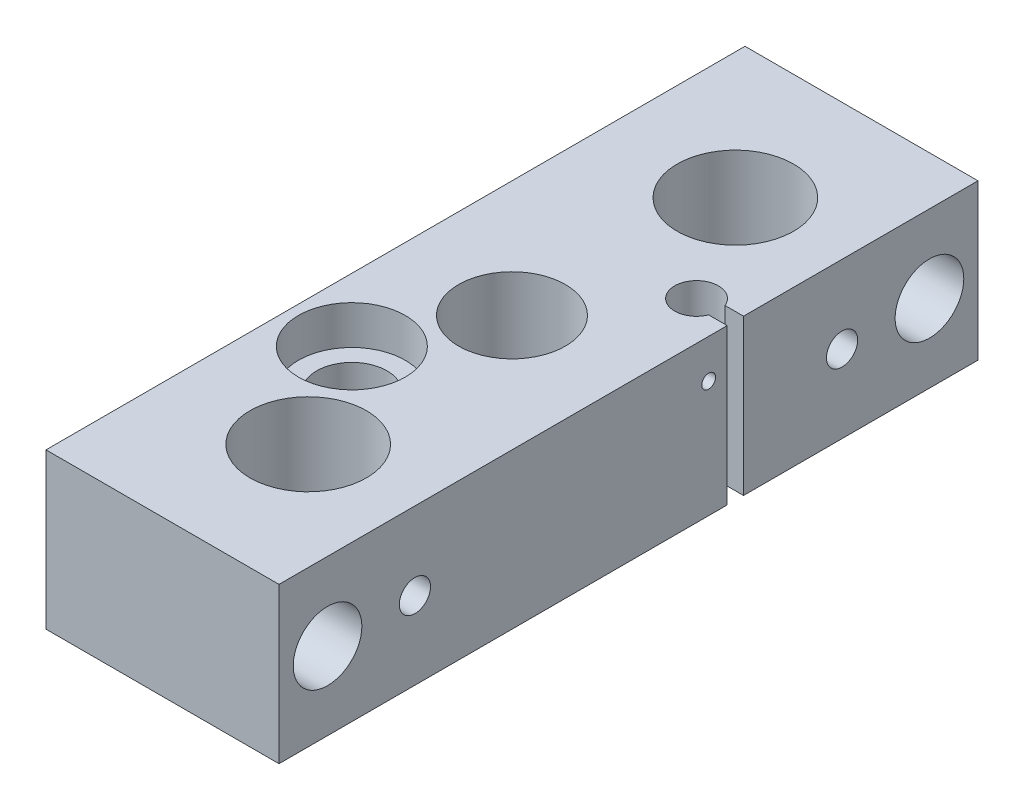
SolidWorks part; units mm, degrees
ref_plane "Front/Back" through (0, 0, 0) normal (0, 0, 1) x (1, 0, 0)
ref_plane "Top/Bottom" through (0, 0, 0) normal (0, 1, 0) x (1, 0, 0)
ref_plane "Right/Left" through (0, 0, 0) normal (1, 0, 0) x (0, 0, -1)
sketch "Sketch1" plane through (0, 0, 0) normal (0, 1, 0) x (1, 0, 0)
  line L0 (0, 0) -> (19.05, 0) construction
  line L1 (-19.05, 57.15) -> (19.05, 57.15)
  line L2 (-19.05, 57.15) -> (-19.05, -57.15)
  line L3 (-19.05, -57.15) -> (19.05, -57.15)
  line L4 (19.05, 57.15) -> (19.05, -57.15)
  line L5 (0, 0) -> (0, 57.15) construction
  dimension "D1" = 38.1
  dimension "D2" = 114.3
extrude "Extrude1" add sketch "Sketch1" along normal mid plane 25.4
sketch "Sketch2" plane through (0, 12.7, 0) normal (0, 1, 0) x (-1, 0, 0)
  line L0 (0, 0) -> (28.5355, 0) construction
  line L1 (0, 0) -> (0, 68.7116) construction
  line L2 (19.05, -57.15) -> (19.05, 57.15) construction
  circle A0 centre (-1.6002, 34.925) radius 9.525
  circle A1 centre (-1.6002, -34.925) radius 9.525
  dimension "D3" = 19.05
  dimension "D1" = 20.6502
  dimension "D2" = 34.925
extrude "Cut-Extrude1" cut sketch "Sketch2" against normal through all
hole_wizard "1/4-20 (Mounting Holes)" positions "Sketch4" profile "Sketch3" tap size "1/4-20" standard "Ansi Inch"
sketch "Sketch4" plane through (19.05, 0, 0) normal (1, 0, 0) x (0, 0, -1)
  line L0 (0, 0) -> (61.5979, 0) construction
  line L1 (-34.925, -12.7) -> (-34.925, 12.7) construction
  line L2 (34.925, -12.7) -> (34.925, 12.7) construction
  point P0 (-34.925, 0)
  point P1 (34.925, 0)
sketch "Sketch3" plane through (19.05, 0, 34.925) normal (0, 1, 0) x (0, 0, -1)
  line L0 (0, 0) -> (0, 7.9248)
  line L1 (0, 7.9248) -> (2.5527, 7.9248)
  line L2 (2.5527, 7.9248) -> (2.5527, 0)
  line L5 (2.5527, 0) -> (0, 0)
  line L11 (0, -6.35) -> (0, 107.95) construction
  dimension "Thru Tap Drill Dia." = 5.1054
  dimension "Thru Tap Drill Depth" = 7.9248
hole_wizard "CBORE for 5/16 Shcs (Mounting Holes)" positions "Sketch6" profile "Sketch5" counterbore size "5/16" standard "Ansi Inch"
sketch "Sketch6" plane through (19.05, 0, 0) normal (1, 0, 0) x (0, 0, -1)
  line L0 (0, 0) -> (0, 22.3919) construction
  line L1 (0, 0) -> (12.7723, 0) construction
  point P0 (49.2125, 0)
  point P1 (-49.2125, 0)
  dimension "D1" = 98.425
sketch "Sketch5" plane through (19.05, 0, -49.2125) normal (0, 1, 0) x (0, 0, -1)
  line L0 (0, 0) -> (0, 38.1)
  line L1 (0, 38.1) -> (4.2164, 38.1)
  line L3 (4.2164, 38.1) -> (4.2164, 7.9375)
  line L4 (4.2164, 7.9375) -> (5.6134, 7.9375)
  line L5 (5.6134, 7.9375) -> (5.6134, 0)
  line L7 (5.6134, 0) -> (0, 0)
  line L11 (0, -6.35) -> (0, 107.95) construction
  dimension "Thru Hole Dia." = 8.4328
  dimension "Thru Hole Depth" = 38.1
  dimension "C'Bore Dia." = 11.2268
  dimension "C'Bore Depth" = 7.9375
sketch "Sketch7" plane through (0, 12.7, 0) normal (0, 1, 0) x (-1, 0, 0)
  line L0 (19.05, -57.15) -> (19.05, 57.15) construction
  line L1 (0, 0) -> (28.8589, 0) construction
  line L2 (0, 0) -> (0, 61.4363) construction
  circle A0 centre (8.7122, 17.4752) radius 8.7376
  dimension "D1" = 17.4752
  dimension "D3" = 17.4752
  dimension "D2" = 10.3378
extrude "Cut-Extrude2" cut sketch "Sketch7" against normal blind 6.35
hole_wizard "1/2-20 (Shock Mount)" positions "Sketch9" profile "Sketch8" tap size "1/2-20" standard "Ansi Inch"
sketch "Sketch9" plane through (0, 6.35, 0) normal (0, 1, 0) x (-1, 0, 0)
  point P0 (8.7122, 17.4752)
sketch "Sketch8" plane through (-8.7122, 6.35, 17.4752) normal (1, 0, 0) x (0, 0, 1)
  line L0 (0, 0) -> (0, 19.05)
  line L1 (0, 19.05) -> (5.7544, 19.05)
  line L2 (5.7544, 19.05) -> (5.7544, 0)
  line L5 (5.7544, 0) -> (0, 0)
  line L11 (0, -6.35) -> (0, 107.95) construction
  dimension "Thru Tap Drill Dia." = 11.5087
  dimension "Thru Tap Drill Depth" = 19.05
sketch "Sketch10" plane through (0, 12.7, 0) normal (0, 1, 0) x (-1, 0, 0)
  circle A0 centre (0, 0) radius 8.7312
  dimension "D1" = 17.4625
extrude "Cut-Extrude3" cut sketch "Sketch10" against normal blind 12.7
hole_wizard "1/8 NPT (Air Port)" positions "Sketch14" profile "Sketch13" size "1/8" standard "Ansi Inch"
sketch "Sketch14" plane through (0, -12.7, 0) normal (0, -1, 0) x (1, 0, 0)
  point P0 (0, 0)
sketch "Sketch13" plane through (0, -12.7, 0) normal (1, 0, 0) x (0, 0, -1)
  line L0 (0, 0) -> (0, 25.4)
  line L1 (0, 25.4) -> (4.2164, 25.4)
  line L2 (-4.5374, 6.924) -> (-4.7447, 0) construction
  line L3 (4.2164, 25.4) -> (4.2164, 6.924)
  line L4 (4.2164, 6.924) -> (4.5374, 6.924)
  line L5 (4.5374, 6.924) -> (4.7447, 0)
  line L7 (4.7447, 0) -> (0, 0)
  line L8 (0, -6.35) -> (0, 107.95) construction
  line L11 (-4.2164, 6.924) -> (-4.5374, 6.924) construction
  dimension "Thru Tap Drill Dia." = 8.4328
  dimension "Thru Tap Drill Depth" = 25.4
  dimension "Thread Dia." = 9.4894
  dimension "Thread Angle" = 3.43
  dimension "Thread Depth" = 6.924
hole_wizard "#4-40 Tapped Hole1" positions "Sketch16" profile "Sketch15" tap size "#4-40" standard "Ansi Inch"
sketch "Sketch16" plane through (19.05, 0, 0) normal (1, 0, 0) x (0, 0, -1)
  line L0 (-57.15, 12.7) -> (57.15, 12.7) construction
  line L1 (0, 0) -> (0, 23.847) construction
  line L2 (0, 0) -> (0, 12.7) construction
  point P0 (13.1064, 6.35)
  dimension "D1" = 6.35
  dimension "D2" = 13.1064
sketch "Sketch15" plane through (19.05, 6.35, -13.1064) normal (0, 1, 0) x (0, 0, -1)
  line L0 (0, 0) -> (0, 13.5062)
  line L1 (0, 13.5062) -> (1.1303, 12.827)
  line L2 (1.1303, 12.827) -> (1.1303, 0)
  line L5 (1.1303, 0) -> (0, 0)
  line L10 (0, 13.5062) -> (-1.1303, 12.827) construction
  line L11 (0, -6.35) -> (0, 107.95) construction
  dimension "Tap Drill Dia." = 2.2606
  dimension "Tap Drill Depth" = 12.827
  dimension "Drill Angle" = 118
sketch "Sketch17" plane through (0, 12.7, 0) normal (0, 1, 0) x (-1, 0, 0)
  line L0 (19.05, -57.15) -> (19.05, 57.15) construction
  line L1 (-19.05, 57.15) -> (-19.05, -57.15) construction
  line L2 (-19.05, -18.8109) -> (-16.0202, -18.8109)
  line L3 (-19.05, -18.8109) -> (-19.05, -16.1395)
  line L4 (-19.05, -16.1395) -> (-16.0202, -16.1395)
  line L6 (-12.7, -17.4752) -> (-17.2873, -17.4752) construction
  arc A0 (-16.0202, -18.8109) -> (-16.0202, -16.1395) centre (-12.7, -17.4752) ccw
  dimension "D1" = 17.4752
  dimension "D2" = 31.75
extrude "Cut-Extrude4 (Sensor Mount)" cut sketch "Sketch17" against normal through all
